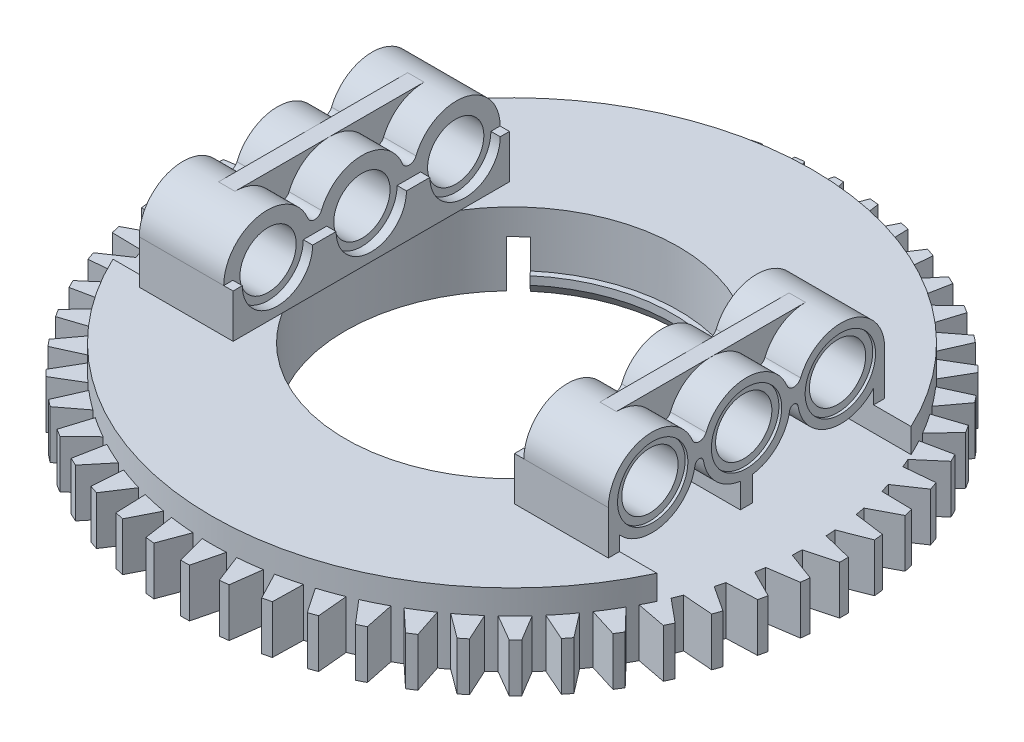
SolidWorks part; units mm, degrees
ref_plane "정면" through (0, 0, 0) normal (0, 0, 1) x (1, 0, 0)
ref_plane "윗면" through (0, 0, 0) normal (0, 1, 0) x (1, 0, 0)
ref_plane "우측면" through (0, 0, 0) normal (1, 0, 0) x (0, 0, -1)
imported_body "불러온 피처3"
sketch "스케치1" plane through (0, 6.2, 0) normal (0, 1, 0) x (-1, 0, 0)
  line L0 (3.5929, 27.7263) -> (3.34, 28.9077)
  line L1 (2.7433, 28.9704) -> (2.2503, 27.8674)
  line L2 (2.2503, 27.8674) -> (1.8298, 26.7375)
  line L3 (3.7692, 26.5336) -> (3.5929, 27.7263)
  arc A0 (3.34, 28.9077) -> (2.7433, 28.9704) centre (0, 0) ccw
  arc A1 (1.8298, 26.7375) -> (3.7692, 26.5336) centre (0, 0) cw
extrude "컷-돌출1" cut sketch "스케치1" against normal blind 2.075
sketch "스케치2" plane through (0, 4.125, 0) normal (0, 1, 0) x (-1, 0, 0)
  line L0 (3.5929, 27.7263) -> (3.34, 28.9077)
  line L1 (2.7433, 28.9704) -> (2.2503, 27.8674)
  line L2 (2.2503, 27.8674) -> (1.8298, 26.7375)
  line L3 (3.7692, 26.5336) -> (3.5929, 27.7263)
  arc A0 (3.34, 28.9077) -> (2.7433, 28.9704) centre (0, 0) ccw
  arc A1 (1.8298, 26.7375) -> (3.7692, 26.5336) centre (0, 0) cw
extrude "컷-돌출2" cut sketch "스케치2" against normal blind 0.685
sketch "스케치63" plane through (0, 0, 0) normal (0, -1, 0) x (1, 0, 0)
  line L0 (-21.4537, 12.835) -> (-13.2978, 12.835)
  line L1 (-13.2978, 12.835) -> (-10.2697, 9.8068)
  line L2 (-9.2214, 10.7984) -> (-9.9306, 11.5075)
  line L3 (9.9306, 11.5075) -> (9.2214, 10.7984)
  line L4 (10.2697, 9.8068) -> (13.2978, 12.835)
  line L5 (13.2978, 12.835) -> (21.4537, 12.835)
  arc A0 (-10.2697, 9.8068) -> (-9.2214, 10.7984) centre (0, 0) cw
  arc A1 (-9.9306, 11.5075) -> (9.9306, 11.5075) centre (0, 0) cw
  arc A2 (9.2214, 10.7984) -> (10.2697, 9.8068) centre (0, 0) cw
  arc A3 (21.4537, 12.835) -> (-21.4537, 12.835) centre (0, 0) ccw
extrude "컷-돌출63" cut sketch "스케치63" against normal blind 0.5
sketch "스케치64" plane through (0, 0.5, 0) normal (0, -1, 0) x (1, 0, 0)
  line L0 (-21.4537, 12.835) -> (-13.2978, 12.835)
  line L1 (-13.2978, 12.835) -> (-10.2697, 9.8068)
  line L2 (-9.2214, 10.7984) -> (-9.9306, 11.5075)
  line L3 (9.9306, 11.5075) -> (9.2214, 10.7984)
  line L4 (10.2697, 9.8068) -> (13.2978, 12.835)
  line L5 (13.2978, 12.835) -> (21.4537, 12.835)
  arc A0 (-10.2697, 9.8068) -> (-9.2214, 10.7984) centre (0, 0) cw
  arc A1 (-9.9306, 11.5075) -> (9.9306, 11.5075) centre (0, 0) cw
  arc A2 (9.2214, 10.7984) -> (10.2697, 9.8068) centre (0, 0) cw
  arc A3 (21.4537, 12.835) -> (-21.4537, 12.835) centre (0, 0) ccw
extrude "컷-돌출64" cut sketch "스케치64" against normal blind 1
sketch "스케치65" plane through (0, 1.5, 0) normal (0, -1, 0) x (1, 0, 0)
  line L0 (-21.4537, 12.835) -> (-13.2978, 12.835)
  line L1 (-13.2978, 12.835) -> (-10.2697, 9.8068)
  line L2 (-9.2214, 10.7984) -> (-9.9306, 11.5075)
  line L3 (9.9306, 11.5075) -> (9.2214, 10.7984)
  line L4 (10.2697, 9.8068) -> (13.2978, 12.835)
  line L5 (13.2978, 12.835) -> (21.4537, 12.835)
  arc A0 (-10.2697, 9.8068) -> (-9.2214, 10.7984) centre (0, 0) cw
  arc A1 (-9.9306, 11.5075) -> (9.9306, 11.5075) centre (0, 0) cw
  arc A2 (9.2214, 10.7984) -> (10.2697, 9.8068) centre (0, 0) cw
  arc A3 (21.4537, 12.835) -> (-21.4537, 12.835) centre (0, 0) ccw
extrude "컷-돌출65" cut sketch "스케치65" against normal blind 2.5
sketch "스케치66" plane through (0, 0, 0) normal (0, -1, 0) x (1, 0, 0)
  line L0 (-10.2697, -9.8068) -> (-10.977, -10.5141)
  line L1 (-10.977, 10.5141) -> (-13.2978, 12.835)
  line L2 (-13.2978, 12.835) -> (-21.4537, 12.835)
  line L3 (21.4537, 12.835) -> (13.2978, 12.835)
  line L4 (13.2978, 12.835) -> (10.977, 10.5141)
  line L5 (10.977, -10.5141) -> (10.2697, -9.8068)
  line L6 (9.2214, -10.7984) -> (9.9306, -11.5075)
  line L7 (-9.9306, -11.5075) -> (-9.2214, -10.7984)
  arc A0 (-10.977, -10.5141) -> (-10.977, 10.5141) centre (0, 0) cw
  arc A1 (-21.4537, 12.835) -> (21.4537, 12.835) centre (0, 0) ccw
  arc A2 (10.977, 10.5141) -> (10.977, -10.5141) centre (0, 0) cw
  arc A3 (10.2697, -9.8068) -> (9.2214, -10.7984) centre (0, 0) cw
  arc A4 (9.9306, -11.5075) -> (-9.9306, -11.5075) centre (0, 0) cw
  arc A5 (-9.2214, -10.7984) -> (-10.2697, -9.8068) centre (0, 0) cw
extrude "컷-돌출66" cut sketch "스케치66" against normal blind 1.5
sketch "스케치67" plane through (0, 1.5, 0) normal (0, -1, 0) x (1, 0, 0)
  line L0 (-10.2697, -9.8068) -> (-10.977, -10.5141)
  line L1 (-10.977, 10.5141) -> (-13.2978, 12.835)
  line L2 (-13.2978, 12.835) -> (-21.4537, 12.835)
  line L3 (21.4537, 12.835) -> (13.2978, 12.835)
  line L4 (13.2978, 12.835) -> (10.977, 10.5141)
  line L5 (10.977, -10.5141) -> (10.2697, -9.8068)
  line L6 (9.2214, -10.7984) -> (9.9306, -11.5075)
  line L7 (-9.9306, -11.5075) -> (-9.2214, -10.7984)
  arc A0 (-10.977, -10.5141) -> (-10.977, 10.5141) centre (0, 0) cw
  arc A1 (-21.4537, 12.835) -> (21.4537, 12.835) centre (0, 0) ccw
  arc A2 (10.977, 10.5141) -> (10.977, -10.5141) centre (0, 0) cw
  arc A3 (10.2697, -9.8068) -> (9.2214, -10.7984) centre (0, 0) cw
  arc A4 (9.9306, -11.5075) -> (-9.9306, -11.5075) centre (0, 0) cw
  arc A5 (-9.2214, -10.7984) -> (-10.2697, -9.8068) centre (0, 0) cw
extrude "컷-돌출67" cut sketch "스케치67" against normal blind 1
sketch "스케치68" plane through (0, 2.5, 0) normal (0, -1, 0) x (1, 0, 0)
  line L0 (21.4537, -12.835) -> (13.2978, -12.835)
  line L1 (13.2978, -12.835) -> (10.2697, -9.8068)
  line L2 (9.2214, -10.7984) -> (9.9306, -11.5075)
  line L3 (-9.9306, -11.5075) -> (-9.2214, -10.7984)
  line L4 (-10.2697, -9.8068) -> (-13.2978, -12.835)
  line L5 (-13.2978, -12.835) -> (-21.4537, -12.835)
  arc A0 (10.2697, -9.8068) -> (9.2214, -10.7984) centre (0, 0) cw
  arc A1 (9.9306, -11.5075) -> (-9.9306, -11.5075) centre (0, 0) cw
  arc A2 (-9.2214, -10.7984) -> (-10.2697, -9.8068) centre (0, 0) cw
  arc A3 (-21.4537, -12.835) -> (21.4537, -12.835) centre (0, 0) ccw
extrude "컷-돌출68" cut sketch "스케치68" against normal blind 1.5
ref_plane "평면1" through (-13.1275, 0, 0) normal (-1, 0, 0) x (0, -1, 0)
sketch "스케치69" plane through (-13.1275, 0, 0) normal (-1, 0, 0) x (0, -1, 0)
  line L0 (-13.64, 8.065) -> (-13.64, -8.065)
  line L1 (-10.67, -11.7086) -> (-10.67, 11.7086)
  arc A0 (-10.67, 11.7086) -> (-13.64, 8.065) centre (-9.92, 8.065) ccw
  arc A1 (-13.64, -8.065) -> (-10.67, -11.7086) centre (-9.92, -8.065) ccw
extrude "컷-돌출69" cut sketch "스케치69" against normal blind 26.255
sketch "스케치70" plane through (-13.1275, 0, 0) normal (1, 0, 0) x (0, 0, -1)
  line L0 (0, 13.64) -> (-8.065, 13.64)
  arc A0 (-8.065, 13.64) -> (-4.6127, 11.3056) centre (-8.065, 9.92) cw
  arc A1 (-4.6127, 11.3056) -> (-3.4523, 11.3056) centre (-4.0325, 11.5385) ccw
  arc A2 (-3.4523, 11.3056) -> (0, 13.64) centre (0, 9.92) cw
extrude "컷-돌출70" cut sketch "스케치70" against normal blind 2.435
sketch "스케치71" plane through (13.1275, 0, 0) normal (-1, 0, 0) x (0, 0, 1)
  line L0 (8.065, 13.64) -> (0, 13.64)
  arc A0 (4.6127, 11.3056) -> (8.065, 13.64) centre (8.065, 9.92) cw
  arc A1 (0, 13.64) -> (3.4523, 11.3056) centre (0, 9.92) cw
  arc A2 (3.4523, 11.3056) -> (4.6127, 11.3056) centre (4.0325, 11.5385) ccw
extrude "컷-돌출71" cut sketch "스케치71" against normal blind 2.435
sketch "스케치72" plane through (20.1625, 0, 0) normal (1, 0, 0) x (0, 0, -1)
  line L0 (0, 13.64) -> (-8.065, 13.64)
  arc A0 (-8.065, 13.64) -> (-4.6127, 11.3056) centre (-8.065, 9.92) cw
  arc A1 (-4.6127, 11.3056) -> (-3.4523, 11.3056) centre (-4.0325, 11.5385) ccw
  arc A2 (-3.4523, 11.3056) -> (0, 13.64) centre (0, 9.92) cw
extrude "컷-돌출72" cut sketch "스케치72" against normal blind 3.2
sketch "스케치73" plane through (20.1625, 0, 0) normal (1, 0, 0) x (0, 0, -1)
  line L0 (8.065, 13.64) -> (0, 13.64)
  arc A0 (0, 13.64) -> (3.4523, 11.3056) centre (0, 9.92) cw
  arc A1 (3.4523, 11.3056) -> (4.6127, 11.3056) centre (4.0325, 11.5385) ccw
  arc A2 (4.6127, 11.3056) -> (8.065, 13.64) centre (8.065, 9.92) cw
extrude "컷-돌출73" cut sketch "스케치73" against normal blind 3.2
sketch "스케치74" plane through (13.1275, 0, 0) normal (-1, 0, 0) x (0, 0, 1)
  line L0 (0, 13.64) -> (-8.065, 13.64)
  arc A0 (-3.4523, 11.3056) -> (0, 13.64) centre (0, 9.92) cw
  arc A1 (-8.065, 13.64) -> (-4.6127, 11.3056) centre (-8.065, 9.92) cw
  arc A2 (-4.6127, 11.3056) -> (-3.4523, 11.3056) centre (-4.0325, 11.5385) ccw
extrude "컷-돌출74" cut sketch "스케치74" against normal blind 2.435
sketch "스케치75" plane through (-13.1275, 0, 0) normal (1, 0, 0) x (0, 0, -1)
  line L0 (8.065, 13.64) -> (0, 13.64)
  arc A0 (0, 13.64) -> (3.4523, 11.3056) centre (0, 9.92) cw
  arc A1 (3.4523, 11.3056) -> (4.6127, 11.3056) centre (4.0325, 11.5385) ccw
  arc A2 (4.6127, 11.3056) -> (8.065, 13.64) centre (8.065, 9.92) cw
extrude "컷-돌출75" cut sketch "스케치75" against normal blind 2.435
sketch "스케치76" plane through (-20.1625, 0, 0) normal (-1, 0, 0) x (0, 0, 1)
  line L0 (0, 13.64) -> (-8.065, 13.64)
  arc A0 (-3.4523, 11.3056) -> (0, 13.64) centre (0, 9.92) cw
  arc A1 (-8.065, 13.64) -> (-4.6127, 11.3056) centre (-8.065, 9.92) cw
  arc A2 (-4.6127, 11.3056) -> (-3.4523, 11.3056) centre (-4.0325, 11.5385) ccw
extrude "컷-돌출76" cut sketch "스케치76" against normal blind 3.2
sketch "스케치77" plane through (-20.1625, 0, 0) normal (-1, 0, 0) x (0, 0, 1)
  line L0 (8.065, 13.64) -> (0, 13.64)
  arc A0 (4.6127, 11.3056) -> (8.065, 13.64) centre (8.065, 9.92) cw
  arc A1 (0, 13.64) -> (3.4523, 11.3056) centre (0, 9.92) cw
  arc A2 (3.4523, 11.3056) -> (4.6127, 11.3056) centre (4.0325, 11.5385) ccw
extrude "컷-돌출77" cut sketch "스케치77" against normal blind 3.2
ref_plane "평면2" through (-14.1625, 0, 0) normal (-1, 0, 0) x (0, -1, 0)
sketch "스케치78" plane through (-14.1625, 0, 0) normal (-1, 0, 0) x (0, -1, 0)
  line L0 (-4.125, -0.53) -> (-4.125, 0.53)
  line L1 (-4.125, 0.53) -> (-6.2, 0.53)
  line L2 (-6.2, 0.53) -> (-6.2, -0.53)
  line L3 (-6.2, -0.53) -> (-4.125, -0.53)
extrude "컷-돌출78" cut sketch "스케치78" against normal blind 28.325
ref_plane "평면3" through (12.3125, 0, 0) normal (1, 0, 0) x (0, 0, -1)
sketch "스케치79" plane through (12.3125, 0, 0) normal (1, 0, 0) x (0, 0, -1)
  line L0 (7.0741, 6.2) -> (11.785, 6.2)
  line L1 (11.785, 6.2) -> (11.785, 9.92)
  line L2 (11.7086, 10.67) -> (-11.7086, 10.67)
  line L3 (-11.785, 9.92) -> (-11.785, 6.2)
  line L4 (-11.785, 6.2) -> (-7.0741, 6.2)
  line L5 (-7.0741, 6.2) -> (7.0741, 6.2)
  arc A0 (11.785, 9.92) -> (11.7086, 10.67) centre (8.065, 9.92) ccw
  arc A1 (-11.7086, 10.67) -> (-11.785, 9.92) centre (-8.065, 9.92) ccw
extrude "컷-돌출79" cut sketch "스케치79" against normal blind 24.625
sketch "스케치80" plane through (12.3125, 0, 0) normal (-1, 0, 0) x (0, 0, 1)
  line L0 (-4.6463, 10.67) -> (-11.4837, 10.67)
  arc A0 (-11.4837, 10.67) -> (-4.6463, 10.67) centre (-8.065, 9.92) ccw
extrude "컷-돌출80" cut sketch "스케치80" against normal blind 0.815
sketch "스케치81" plane through (12.3125, 0, 0) normal (-1, 0, 0) x (0, 0, 1)
  line L0 (2.9821, 10.67) -> (-2.9821, 10.67)
  arc A0 (-2.9821, 10.67) -> (2.9821, 10.67) centre (0, 9.92) ccw
extrude "컷-돌출81" cut sketch "스케치81" against normal blind 0.815
sketch "스케치82" plane through (12.3125, 0, 0) normal (-1, 0, 0) x (0, 0, 1)
  line L0 (11.4837, 10.67) -> (4.6463, 10.67)
  arc A0 (4.6463, 10.67) -> (11.4837, 10.67) centre (8.065, 9.92) ccw
extrude "컷-돌출82" cut sketch "스케치82" against normal blind 0.815
sketch "스케치83" plane through (-12.3125, 0, 0) normal (1, 0, 0) x (0, 0, -1)
  line L0 (-4.6463, 10.67) -> (-11.4837, 10.67)
  arc A0 (-11.4837, 10.67) -> (-4.6463, 10.67) centre (-8.065, 9.92) ccw
extrude "컷-돌출83" cut sketch "스케치83" against normal blind 0.815
sketch "스케치84" plane through (-12.3125, 0, 0) normal (1, 0, 0) x (0, 0, -1)
  line L0 (2.9821, 10.67) -> (-2.9821, 10.67)
  arc A0 (-2.9821, 10.67) -> (2.9821, 10.67) centre (0, 9.92) ccw
extrude "컷-돌출84" cut sketch "스케치84" against normal blind 0.815
sketch "스케치85" plane through (-12.3125, 0, 0) normal (1, 0, 0) x (0, 0, -1)
  line L0 (11.4837, 10.67) -> (4.6463, 10.67)
  arc A0 (4.6463, 10.67) -> (11.4837, 10.67) centre (8.065, 9.92) ccw
extrude "컷-돌출85" cut sketch "스케치85" against normal blind 0.815
hole_wizard "M4 육각 머리 작은 나사용 카운터보어1" positions "스케치87" profile "스케치86" counterbore size "M4" standard "Ansi Metric"
sketch "스케치87" plane through (-20.1625, 0, 0) normal (-1, 0, 0) x (0, 0, 1)
  point P0 (0, 9.92)
  point P1 (-8, 9.92)
  point P2 (8, 9.92)
  dimension "D1" = 8
  dimension "D2" = 8
sketch "스케치86" plane through (-20.1625, 9.92, 0) normal (0, 1, 0) x (0, 0, 1)
  line L0 (0, 0) -> (0, 7.035)
  line L1 (0, 7.035) -> (2.4, 7.035)
  line L3 (2.4, 7.035) -> (2.4, 0.4)
  line L4 (2.4, 0.4) -> (3, 0.4)
  line L5 (3, 0.4) -> (3, 0)
  line L7 (3, 0) -> (0, 0)
  line L11 (0, -6.35) -> (0, 107.95) construction
  dimension "관통 구멍 지름" = 4.8
  dimension "관통 구멍 깊이" = 7.035
  dimension "카운터보어 지름" = 6
  dimension "카운터보어 깊이" = 0.4
hole_wizard "M4 육각 머리 작은 나사용 카운터보어2" positions "스케치89" profile "스케치88" counterbore size "M4" standard "Ansi Metric"
sketch "스케치89" plane through (20.1625, 0, 0) normal (1, 0, 0) x (0, 0, -1)
  point P0 (0, 9.92)
  point P1 (8, 9.92)
  point P2 (-8, 9.92)
  dimension "D1" = 8
  dimension "D2" = 8
sketch "스케치88" plane through (20.1625, 9.92, 0) normal (0, 1, 0) x (0, 0, -1)
  line L0 (0, 0) -> (0, 49.2625)
  line L1 (0, 49.2625) -> (2.4, 49.2625)
  line L3 (2.4, 49.2625) -> (2.4, 0.4)
  line L4 (2.4, 0.4) -> (3, 0.4)
  line L5 (3, 0.4) -> (3, 0)
  line L7 (3, 0) -> (0, 0)
  line L11 (0, -6.35) -> (0, 107.95) construction
  dimension "관통 구멍 지름" = 4.8
  dimension "관통 구멍 깊이" = 49.2625
  dimension "카운터보어 지름" = 6
  dimension "카운터보어 깊이" = 0.4
sketch "스케치90" plane through (0, 0, 0) normal (0, 1, 0) x (1, 0, 0)
  circle A0 centre (0, 0) radius 29.1
  circle A1 centre (0, 0) radius 26.8
  dimension "D2" = 58.2
extrude "컷-돌출87" cut sketch "스케치90" against normal through all both and the other way through all
sketch "스케치92" plane through (0, 4.125, 0) normal (0, 1, 0) x (1, 0, 0)
  line L0 (3.5929, 27.7263) -> (3.34, 28.9077)
  line L1 (2.7433, 28.9704) -> (2.2503, 27.8674)
  line L2 (2.2503, 27.8674) -> (1.8298, 26.7375)
  line L3 (3.7692, 26.5336) -> (3.5929, 27.7263)
  arc A0 (3.34, 28.9077) -> (2.7433, 28.9704) centre (0, 0) ccw
  arc A1 (1.8298, 26.7375) -> (3.7692, 26.5336) centre (0, 0) cw
extrude "보스-돌출1" add sketch "스케치92" against normal up to surface (4.125 mm away)
pattern_circular "원형 패턴1" count 56 over 360 about axis through (0, 0, 0) along (0, 1, 0) of "보스-돌출1"
sketch "스케치93" plane through (0, 4.125, 0) normal (0, 1, 0) x (1, 0, 0)
  circle A0 centre (0, 0) radius 28.1
  circle A1 centre (0, 0) radius 36.0499
  dimension "D1" = 56.2
extrude "컷-돌출88" cut sketch "스케치93" against normal blind 10
sketch "스케치94" plane through (0, 6.2, 0) normal (0, 1, 0) x (1, 0, 0)
  line L0 (-2.9784, 27.9417) -> (-2.0355, 25.519)
  line L1 (-0.5892, 28.0938) -> (-1.2172, 25.571)
  line L3 (-2.2296, 26.7071) -> (-2.6669, 27.8307) construction
  line L4 (-0.884, 27.9442) -> (-1.1753, 26.7742) construction
  arc A0 (-2.7303, 27.967) -> (-3.978, 27.817) centre (0, 0) ccw construction
  arc A1 (0.4182, 28.0969) -> (-0.8384, 28.0875) centre (0, 0) ccw construction
  arc A2 (-1.2172, 25.571) -> (-2.0355, 25.519) centre (0, 0) ccw
  arc A3 (24.5121, 10.835) -> (-24.5121, 10.835) centre (0, 0) ccw construction
  arc A4 (-0.5892, 28.0938) -> (-2.9784, 27.9417) centre (0, 0) ccw
  dimension "D3" = 1.2
  dimension "D1" = 0.25
  dimension "D2" = 0.25
extrude "컷-돌출89" cut sketch "스케치94" against normal blind 10
pattern_circular "원형 패턴2" count 56 over 360 about axis through (0, 0, 0) along (0, 1, 0) of "컷-돌출89"
sketch "스케치95" plane through (0, 6.2, 0) normal (0, 1, 0) x (1, 0, 0)
  circle A0 centre (0, 0) radius 26.8
  circle A1 centre (0, 0) radius 25.6
extrude "컷-돌출90" cut sketch "스케치95" against normal up to surface (2.075 mm away)
ref_plane "Plane1" through (20, 0, 0) normal (1, 0, 0) x (0, 0, -1)
ref_plane "Plane2" through (-20, 0, 0) normal (1, 0, 0) x (0, 0, -1)
sketch "Sketch1" plane through (-20.1625, 0, 0) normal (-1, 0, 0) x (0, 0, 1)
  line L0 (0.53, 6.2) -> (11.785, 6.2)
  line L1 (-11.785, 6.2) -> (-1.429, 6.2)
  line L2 (-11.785, 6.2) -> (-11.785, 15.0964)
  line L3 (-11.785, 15.0964) -> (11.785, 15.0964)
  line L4 (11.785, 6.2) -> (11.785, 15.0964)
  line L6 (-1.429, 6.2) -> (-1.429, 4.125)
  line L7 (-1.429, 4.125) -> (0.53, 4.125)
  line L8 (0.53, 6.2) -> (0.53, 4.125)
extrude "Cut-Extrude1" cut sketch "Sketch1" against normal up to surface (0.1625 mm away)
sketch "Sketch2" plane through (20.1625, 0, 0) normal (1, 0, 0) x (0, 0, -1)
  line L0 (1.0313, 6.2) -> (11.785, 6.2)
  line L1 (-11.785, 6.2) -> (-1.0313, 6.2)
  line L2 (-11.785, 6.2) -> (-11.785, 14.8501)
  line L3 (-11.785, 14.8501) -> (11.785, 14.8501)
  line L4 (11.785, 6.2) -> (11.785, 14.8501)
  line L6 (-1.0313, 6.2) -> (-1.0313, 4.125)
  line L7 (-1.0313, 4.125) -> (1.0313, 4.125)
  line L8 (1.0313, 6.2) -> (1.0313, 4.125)
extrude "Cut-Extrude2" cut sketch "Sketch2" against normal up to surface (0.1625 mm away)
ref_plane "Plane3" through (12, 0, 0) normal (1, 0, 0) x (0, 0, -1)
ref_plane "Plane4" through (-12, 0, 0) normal (1, 0, 0) x (0, 0, -1)
ref_plane "Plane5" through (-16.9625, 13.64, -8.065) normal (0, 0, -1) x (-1, 0, 0)
sketch "Sketch5" plane through (13.1275, 0, 0) normal (-1, 0, 0) x (0, 0, 1)
  line L0 (-11.785, 9.92) -> (-11.785, 6.2)
  line L1 (-11.785, 6.2) -> (11.785, 6.2)
  line L2 (11.785, 6.2) -> (11.785, 9.92)
  arc A0 (-4.6127, 11.3056) -> (-11.785, 9.92) centre (-8.065, 9.92) ccw
  arc A1 (3.4523, 11.3056) -> (-3.4523, 11.3056) centre (0, 9.92) ccw
  arc A2 (11.785, 9.92) -> (4.6127, 11.3056) centre (8.065, 9.92) ccw
  arc A3 (-4.6127, 11.3056) -> (-3.4523, 11.3056) centre (-4.0325, 11.5385) ccw
  arc A4 (3.4523, 11.3056) -> (4.6127, 11.3056) centre (4.0325, 11.5385) ccw
extrude "Boss-Extrude1" add sketch "Sketch5" along normal up to surface (1.1275 mm away)
sketch "Sketch6" plane through (12, 0, 0) normal (-1, 0, 0) x (0, 0, 1)
  circle A0 centre (-8, 9.92) radius 2.4
  circle A1 centre (0, 9.92) radius 2.4
  circle A2 centre (8, 9.92) radius 2.4
  dimension "D1" = 8
  dimension "D2" = 8
extrude "Cut-Extrude3" cut sketch "Sketch6" against normal through all
sketch "Sketch7" plane through (-13.1275, 0, 0) normal (1, 0, 0) x (0, 0, -1)
  line L0 (-11.785, 9.92) -> (-11.785, 6.2)
  line L1 (-11.785, 6.2) -> (11.785, 6.2)
  line L2 (11.785, 6.2) -> (11.785, 9.92)
  arc A0 (-4.6127, 11.3056) -> (-11.785, 9.92) centre (-8.065, 9.92) ccw
  arc A1 (3.4523, 11.3056) -> (-3.4523, 11.3056) centre (0, 9.92) ccw
  arc A2 (11.785, 9.92) -> (4.6127, 11.3056) centre (8.065, 9.92) ccw
  arc A3 (-4.6127, 11.3056) -> (-3.4523, 11.3056) centre (-4.0325, 11.5385) ccw
  arc A4 (3.4523, 11.3056) -> (4.6127, 11.3056) centre (4.0325, 11.5385) ccw
extrude "Boss-Extrude2" add sketch "Sketch7" along normal up to surface (1.1275 mm away)
sketch "Sketch8" plane through (-12, 0, 0) normal (1, 0, 0) x (0, 0, -1)
  circle A0 centre (-8, 9.92) radius 2.4
  circle A1 centre (0, 9.92) radius 2.4
  circle A3 centre (8, 9.92) radius 2.4
  dimension "D1" = 8
  dimension "D2" = 8
extrude "Cut-Extrude4" cut sketch "Sketch8" against normal through all
sketch "Sketch9" plane through (-12, 0, 0) normal (1, 0, 0) x (0, 0, -1)
  line L1 (-13.8532, 9.92) -> (-13.8532, 17.8745)
  line L2 (-13.8532, 17.8745) -> (13.5702, 17.8745)
  line L3 (13.5702, 17.8745) -> (13.5702, 9.92)
  line L4 (-5, 9.92) -> (-3, 9.92)
  line L8 (3, 9.92) -> (5, 9.92)
  line L9 (11, 9.92) -> (13.5702, 9.92)
  line L10 (-11, 9.92) -> (-13.8532, 9.92)
  arc A1 (-3, 9.92) -> (3, 9.92) centre (0, 9.92) ccw
  arc A3 (-11, 9.92) -> (-5, 9.92) centre (-8, 9.92) ccw
  arc A5 (5, 9.92) -> (11, 9.92) centre (8, 9.92) ccw
extrude "Cut-Extrude6" cut sketch "Sketch9" against normal blind 0.8
mirror "Mirror1" about plane through (0, 0, 0) normal (1, 0, 0) of "Cut-Extrude6"
